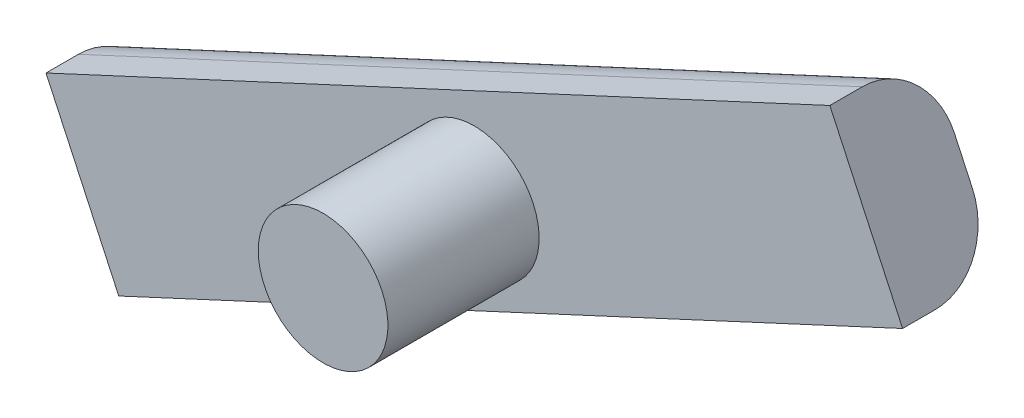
SolidWorks part; units mm, degrees
ref_plane "Alzado" through (0, 0, 0) normal (0, 0, 1) x (1, 0, 0)
ref_plane "Planta" through (0, 0, 0) normal (0, 1, 0) x (1, 0, 0)
ref_plane "Vista lateral" through (0, 0, 0) normal (1, 0, 0) x (0, 0, -1)
sketch3d "Sk_Vastago"
  line L0 (455.3416, 345.3626, 22) -> (455.3416, 345.3626, 15)
sweep "Vastago" add path "Sk_Vastago" parameters "D3"=6
sketch "Sk_Goma" plane through (0, 0, 0) normal (0, 0, 1) x (1, 0, 0)
  line L0 (438.8839, 333.315) -> (435.5162, 340.5716)
  line L1 (435.5162, 340.5716) -> (471.7992, 357.4103)
  line L2 (471.7992, 357.4103) -> (475.1669, 350.1537)
  line L3 (475.1669, 350.1537) -> (438.8839, 333.315)
extrude "Goma" add sketch "Sk_Goma" along normal blind 4.5 from offset 10.5
fillet "Redondeo2" radius 3 2 edges at (453.6577, 348.9909, 10.5) (457.0254, 341.7343, 10.5)
